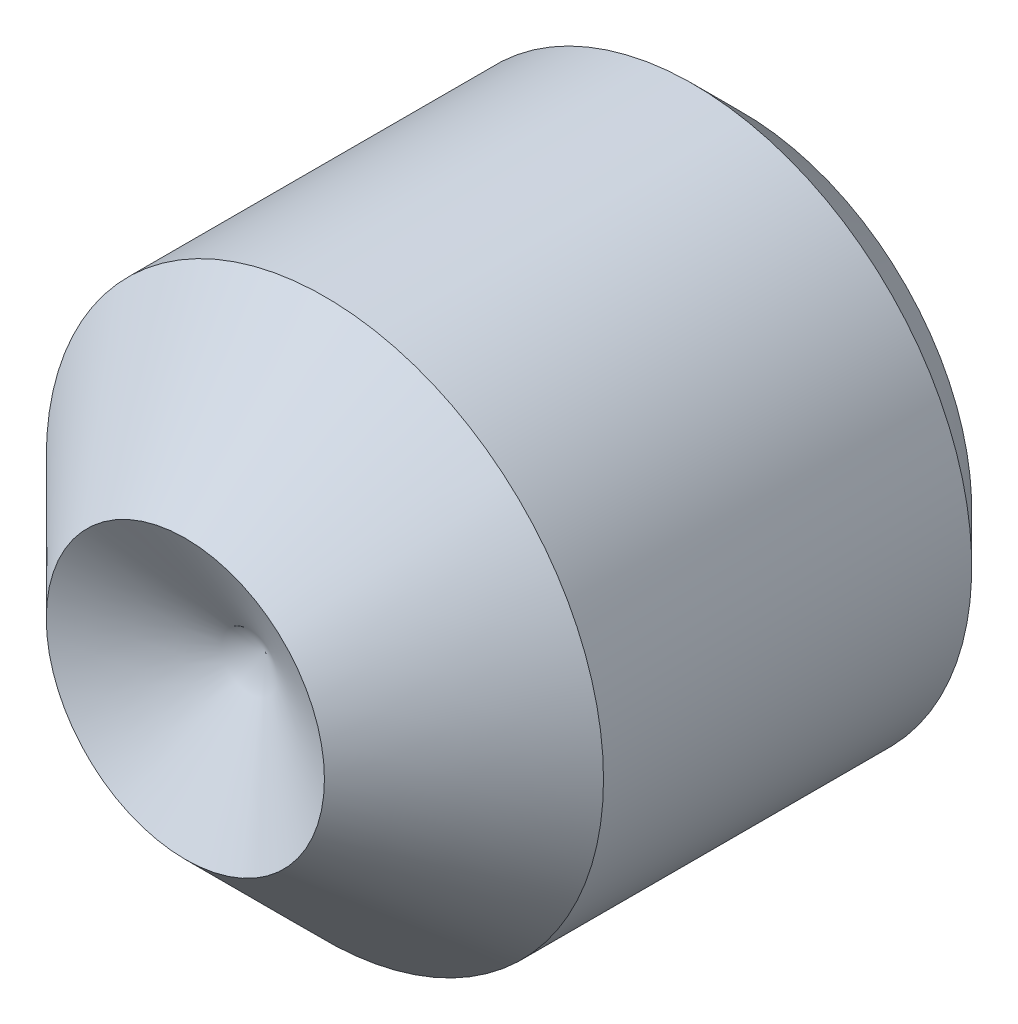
SolidWorks part; units mm, degrees
ref_plane "Front" through (0, 0, 0) normal (0, 0, 1) x (1, 0, 0)
ref_plane "Top" through (0, 0, 0) normal (0, 1, 0) x (1, 0, 0)
ref_plane "Right" through (0, 0, 0) normal (1, 0, 0) x (0, 0, -1)
sketch "Logo3_Revol_Axis" plane through (0, 0, 0) normal (0, 1, 0) x (1, 0, 0)
  line L0 (0, -43.5172) -> (0, 43.5172) construction
sketch "Logo3_bib1" plane through (0, 0, 0) normal (0, -1, 0) x (-1, 0, 0)
  line L0 (0, -7.9375) -> (0, 0)
  line L1 (0, -7.9375) -> (5, -7.9375) construction
  line L2 (1.4097, 0) -> (1.4097, -7.9375) construction
  line L3 (0, 0) -> (3.2639, 0)
  line L4 (3.9688, -0.7048) -> (3.9688, -7.2326)
  line L5 (1.4097, 0) -> (0, -1.4097) construction
  line L6 (0.7049, -0.7048) -> (3.9688, -0.7048) construction
  line L7 (3.9688, -0.7048) -> (3.2639, 0) construction
  line L8 (3.2639, 0) -> (3.9688, -0.7048)
  line L9 (3.2639, 0) -> (3.2639, -7.9375) construction
  line L10 (0, 10.5852) -> (0, -63.2873) construction
  line L11 (3.2639, -7.9375) -> (3.9688, -7.2326) construction
  line L12 (3.2639, -7.9375) -> (0, -7.9375)
  line L13 (3.9688, -7.2326) -> (3.2639, -7.9375)
revolve "Revolve1" add sketch "Logo3_bib1" angle 360 about L10
sketch "Logo3_bib11" plane through (0, 0, 0) normal (0, 0, -1) x (1, 0, 0)
  line L1 (2.2906, 0) -> (1.1453, 1.9837)
  line L2 (1.1453, 1.9837) -> (-1.1453, 1.9837)
  line L3 (-1.1453, 1.9837) -> (-2.2906, 0)
  line L4 (-2.2906, 0) -> (-1.1453, -1.9837)
  line L5 (-1.1453, -1.9837) -> (1.1453, -1.9837)
  line L6 (1.1453, -1.9837) -> (2.2906, 0)
  circle A0 centre (0, 0) radius 1.9837 construction
  dimension "Logo3_key" = 3.9675
extrude "Cut-Extrude1" cut sketch "Logo3_bib11" against normal blind 2.5
sketch "Logo3_bib2" [suppressed] plane through (0, 0, 0) normal (0, 1, 0) x (1, 0, 0)
  line L0 (-3.1431, -30) -> (-3.1431, 0) construction
  line L1 (-4, -30) -> (0, -30) construction
  line L2 (0, 0) -> (-4, 0) construction
  line L3 (0, -43.5172) -> (0, 43.5172) construction
  line L4 (-5, -29) -> (0, -29) construction
  line L5 (-3.1431, -29) -> (-0.7675, -30)
  line L6 (0, -26.2867) -> (-4, -26.2867) construction
  line L11 (-4, 0) -> (-4, -30) construction
  line L12 (-4, -26.2867) -> (-5, -24.6806) construction
  line L13 (-5, -1) -> (-5, -29) construction
  line L15 (-5, -24.6806) -> (-7, -24.6806)
  line L16 (-7, -24.6806) -> (-7, -32.5)
  line L17 (-7, -32.5) -> (-0.7675, -32.5)
  line L18 (-5, -24.6806) -> (-4, -26.2867)
  line L19 (-4, -26.2867) -> (-3.1431, -26.2867)
  line L20 (-3.1431, -26.2867) -> (-3.1431, -29)
  line L21 (-0.7675, -30) -> (-0.7675, -32.5)
  line L22 (0, 0) -> (0, -32.5) construction
  dimension "D1" = 22.828
  dimension "D2" = 58.093
  dimension "D3" = 2
  dimension "logo3_d2" = 12
  dimension "logo3_l2" = 3.7133
  dimension "D4" = 2.5
revolve "Type2" [suppressed] cut sketch "Logo3_bib2" angle 360 about L0
sketch "Logo3_bib3" plane through (0, 0, 0) normal (0, 1, 0) x (1, 0, 0)
  line L0 (0, 0) -> (0, -7.9375) construction
  line L1 (0, -7.9375) -> (-5, -7.9375) construction
  line L2 (1.9812, -7.9375) -> (1.9812, -8.9375) construction
  line L4 (-1.9812, -7.9375) -> (-3.9688, -5.9499)
  line L5 (-3.9688, -0.7048) -> (-3.9688, -7.2326) construction
  line L6 (-3.9688, -5.9499) -> (-4.9688, -5.9499)
  line L7 (-4.9688, -5.9499) -> (-4.9688, -8.9375)
  line L8 (-4.9688, -8.9375) -> (0, -8.9375)
  line L9 (0, 10.5852) -> (0, -63.2873) construction
  line L10 (-1.9812, -7.9375) -> (0, -6.7937)
  line L12 (0, -6.7937) -> (0, -8.9375)
  line L13 (-1.9812, -7.9375) -> (-1.9812, -8.9375) construction
  dimension "D1" = 30
  dimension "logo3_d2" = 3.9624
  dimension "D2" = 45
  dimension "D3" = 1
  dimension "D4" = 1
revolve "Type3" cut sketch "Logo3_bib3" angle 360 about L0
sketch "Logo3_bib4" [suppressed] plane through (0, 0, 0) normal (0, 1, 0) x (1, 0, 0)
  line L0 (0, 0) -> (0, -30) construction
  line L1 (-2.9915, 0) -> (-2.9915, -30) construction
  line L2 (0, 0) -> (-4, 0) construction
  line L3 (-4, -30) -> (0, -30) construction
  line L4 (-2.9915, -30) -> (-5, -27.8033)
  line L5 (-5, -1) -> (-5, -29) construction
  line L6 (-5, -27.8033) -> (-7.5117, -27.8033)
  line L7 (-7.5117, -27.8033) -> (-7.5117, -34.0728)
  line L8 (-7.5117, -34.0728) -> (-2.9915, -34.0728)
  line L9 (-2.9915, -34.0728) -> (-2.9915, -30)
  dimension "D1" = 47.562
  dimension "logo3_d2" = 12
  dimension "D2" = 2.5117
  dimension "D3" = 4.0728
revolve "Type4" [suppressed] cut sketch "Logo3_bib4" angle 360 about L0
equation "\"D2@Cosmetic Thread1\" = \"logo3_d1@Logo3_bib1\"-\"logo3_pas@Logo3_bib1\""
